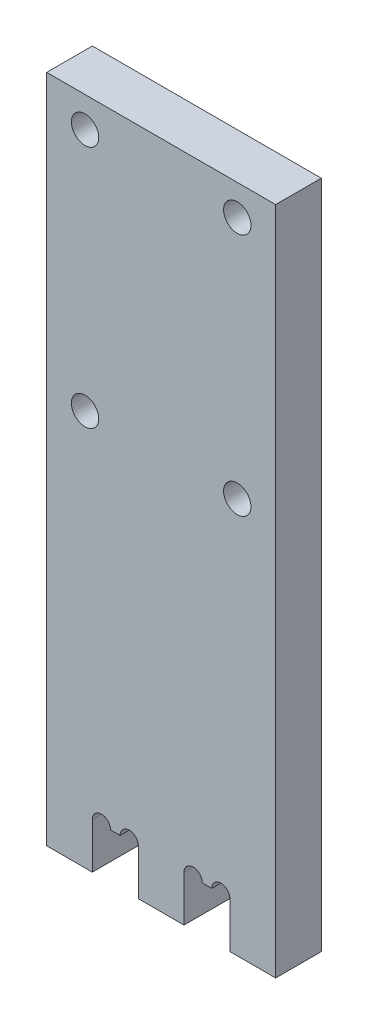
SolidWorks part; units mm, degrees
ref_plane "Ebene vorne" through (0, 0, 0) normal (0, 0, 1) x (1, 0, 0)
ref_plane "Ebene oben" through (0, 0, 0) normal (0, 1, 0) x (1, 0, 0)
ref_plane "Ebene rechts" through (0, 0, 0) normal (1, 0, 0) x (0, 0, -1)
sketch "Skizze1" plane through (0, 0, 0) normal (0, 0, 1) x (1, 0, 0)
  line L0 (0, 0) -> (0, -15)
  line L1 (75.2, -8.2303) -> (75.2, 205)
  line L2 (75.2, 205) -> (0, 205)
  line L3 (0, 205) -> (0, 0)
  line L4 (0, -15) -> (15, -15)
  line L5 (15, -15) -> (15, 0)
  line L6 (30.1, 0) -> (30.1, -15)
  line L7 (30.1, -15) -> (45.1, -15)
  line L8 (45.1, -15) -> (45.1, 0)
  line L9 (60.2, 0) -> (60.2, -15)
  line L10 (60.2, -15) -> (75.2, -15)
  line L11 (75.2, -15) -> (75.2, -8.2303)
  line L12 (21, 0) -> (24.1, 0)
  line L13 (51.1, 0) -> (54.2, 0)
  arc A0 (54.2, 0) -> (60.2, 0) centre (57.2, 0) cw
  arc A1 (51.1, 0) -> (45.1, 0) centre (48.1, 0) ccw
  arc A2 (15, 0) -> (21, 0) centre (18, 0) cw
  arc A3 (24.1, 0) -> (30.1, 0) centre (27.1, 0) cw
  circle A4 centre (12.6, 115) radius 4.5
  circle A5 centre (62.6, 115) radius 4.5
  circle A6 centre (12.6, 195) radius 4.5
  circle A7 centre (62.6, 195) radius 4.5
  dimension "D2" = 3
  dimension "D15" = 3
  dimension "D16" = 3
  dimension "D17" = 3
  dimension "D19" = 9
  dimension "D20" = 9
  dimension "D21" = 12.6
  dimension "D22" = 12.6
  dimension "D23" = 130
  dimension "D24" = 9
  dimension "D25" = 9
  dimension "D27" = 80
  dimension "D28" = 80
  dimension "D29" = 130
  dimension "D3" = 15
  dimension "D4" = 15
  dimension "D5" = 15.1
  dimension "D6" = 15
  dimension "D7" = 15.1
  dimension "D8" = 15
  dimension "D9" = 15
  dimension "D10" = 15
  dimension "D11" = 15
  dimension "D12" = 15
  dimension "D13" = 0
  dimension "D14" = 0
  dimension "D18" = 50
  dimension "D26" = 50
  dimension "D30" = 10
extrude "Aufsatz-Linear austragen1" add sketch "Skizze1" along normal blind 15
